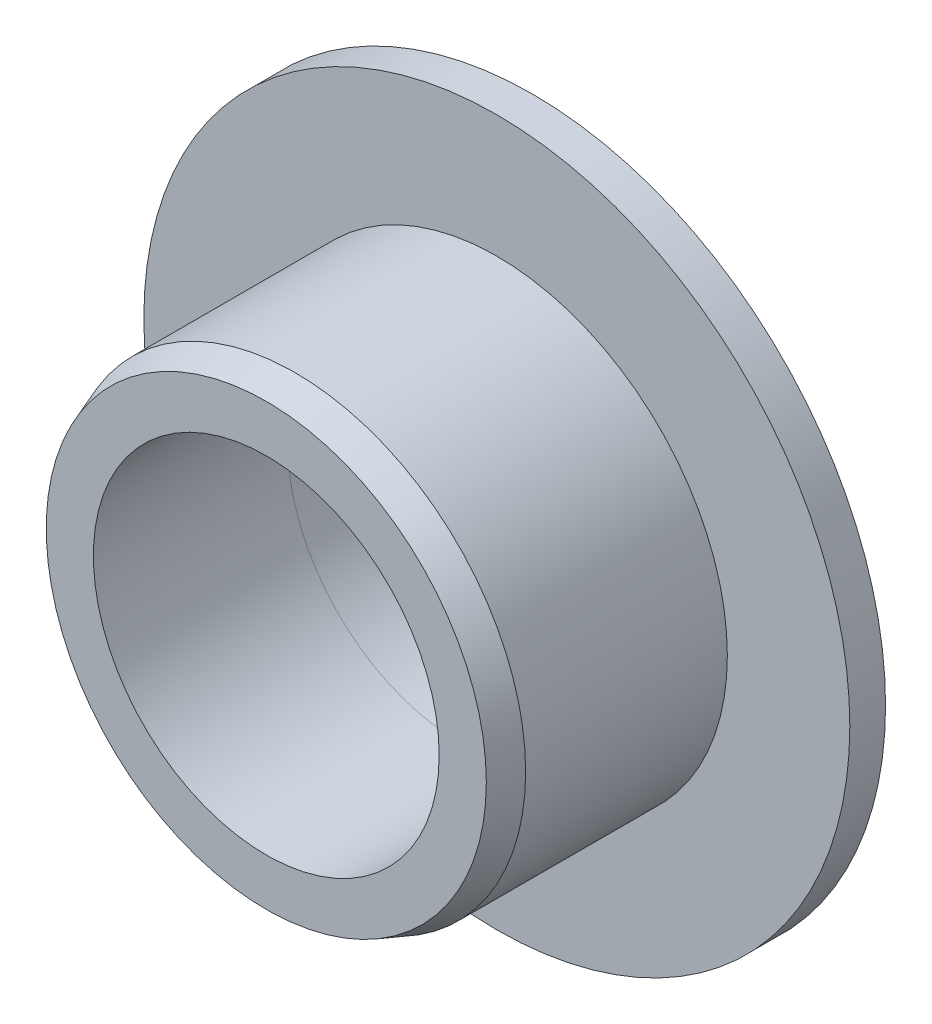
SolidWorks part; units mm, degrees
ref_plane "Plan1" through (0, 0, 0) normal (0, 0, 1) x (1, 0, 0)
ref_plane "Plan2" through (0, 0, 0) normal (0, 1, 0) x (1, 0, 0)
ref_plane "Plan3" through (0, 0, 0) normal (1, 0, 0) x (0, 0, -1)
sketch "Esquisse1" plane through (0, 0, 0) normal (0, 0, 1) x (1, 0, 0)
  circle A0 centre (0, 0) radius 24.5
  dimension "D1" = 49
extrude "Base-Extrusion" add sketch "Esquisse1" along normal blind 2.48
sketch "Esquisse2" plane through (0, 0, 2.48) normal (0, 0, 1) x (1, 0, 0)
  circle A0 centre (0, 0) radius 16
  dimension "D1" = 32
extrude "Boss.-Extru.1" add sketch "Esquisse2" along normal blind 16
chamfer "Chanfrein1" distance 2 angle 20 1 edges at (16, 0, 18.48)
sketch "Esquisse3" plane through (0, 0, 18.48) normal (0, 0, 1) x (1, 0, 0)
  circle A0 centre (0, 0) radius 12
  dimension "D1" = 24
extrude "Enlèv. mat.-Extru.1" cut sketch "Esquisse3" against normal through all
chamfer "Chanfrein2" distance 0.5 angle 45 1 edges at (12, 0, 0)
sketch "Esquisse4" plane through (0, 0, 0) normal (0, 0, -1) x (-1, 0, 0)
  circle A0 centre (0, 0) radius 12.05
  dimension "D1" = 24.1
extrude "Enlèv. mat.-Extru.2" cut sketch "Esquisse4" against normal blind 5
